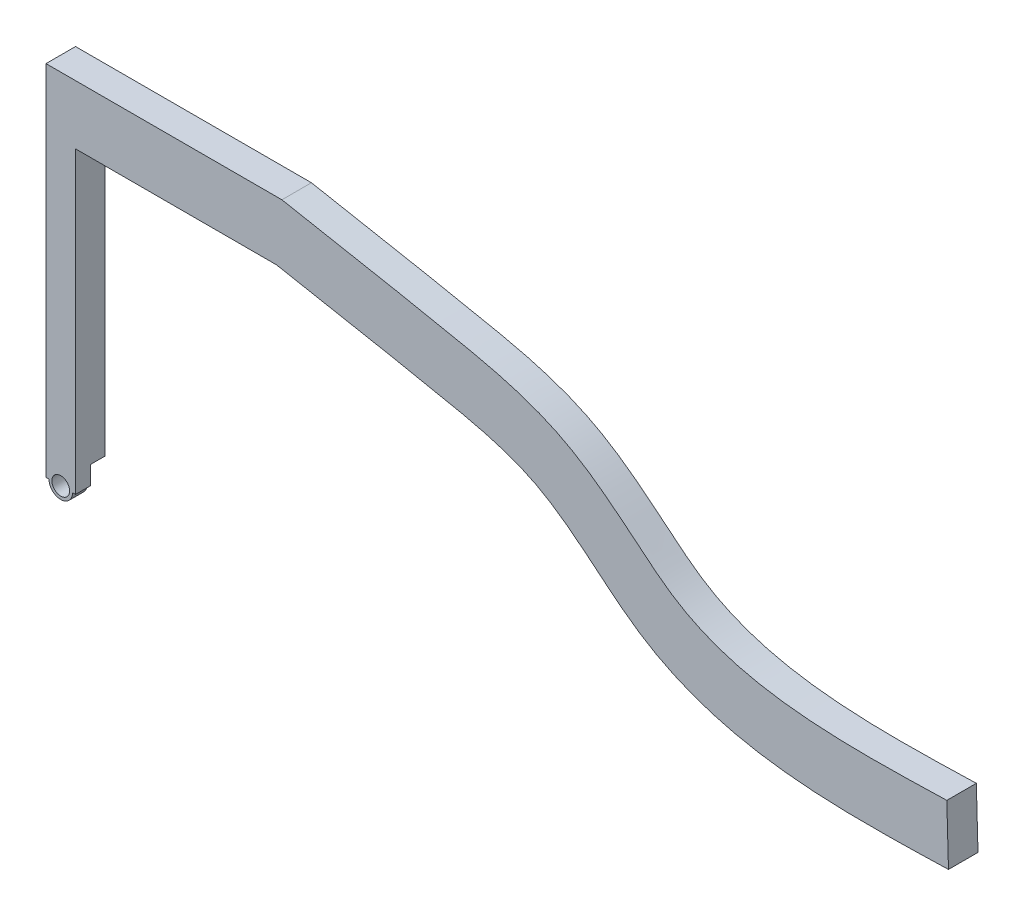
SolidWorks part; units mm, degrees
ref_plane "Front Plane" through (0, 0, 0) normal (0, 0, 1) x (1, 0, 0)
ref_plane "Top Plane" through (0, 0, 0) normal (0, 1, 0) x (1, 0, 0)
ref_plane "Right Plane" through (0, 0, 0) normal (1, 0, 0) x (0, 0, -1)
sketch "Sketch2" plane through (0, 0, 0) normal (0, 0, 1) x (1, 0, 0)
  line L0 (0, 0) -> (0, 13.3821)
  line L1 (0, 13.3821) -> (8.6425, 13.3821)
  spline S0 degree 3 poles (8.6425, 13.3821) (11.0062, 12.9415) (14.7474, 12.2441) (20.4161, 11.0334) (25.9492, 4.9848) (32.7321, 5.176) (37.5492, 5.3118) knots 0 0 0 0 0.238093 0.376845 0.55745 1 1 1 1
extrude "Extrude-Thin1" add sketch "Sketch2" along normal blind 1.27 thin
sketch "Sketch3" plane through (0, 0, 1.27) normal (0, 0, 1) x (1, 0, 0)
  line L0 (-1.27, 0) -> (-1.27, 15.9221)
  line L1 (0, 0) -> (-2.54, 0) construction
  line L2 (-2.54, 15.9221) -> (8.8772, 15.9221) construction
extrude "Extrude1" cut sketch "Sketch3" against normal through all and the other way through all
sketch "Sketch4" plane through (0, 0, 1.27) normal (0, 0, 1) x (1, 0, 0)
  circle A0 centre (-0.635, 0.508) radius 0.381
extrude "Extrude2" cut sketch "Sketch4" against normal through all
sketch "Sketch8" plane through (0, 0, 0) normal (1, 0, 0) x (0, 0, -1)
  line L0 (-0.635, 0) -> (-0.635, 1.016)
  line L1 (-1.27, 0) -> (0, 0) construction
  line L2 (-0.635, 1.016) -> (0, 1.016)
  line L4 (0, 0) -> (0, 13.3821) construction
extrude "Extrude6" cut sketch "Sketch8" against normal through all flip side to cut
sketch "Sketch12" plane through (0, 0, 0) normal (0, 0, -1) x (-1, 0, 0)
  circle A0 centre (0.635, 0.508) radius 1.016
extrude "Extrude10" cut sketch "Sketch12" against normal up to surface (0.635 mm away)
sketch "Sketch13" plane through (0, 0, 0.635) normal (0, 0, -1) x (-1, 0, 0)
  line L0 (0, 0) -> (1.27, 0) construction
  line L1 (0.127, 0.508) -> (0, 0.508)
  line L2 (0, 0) -> (0, 1.3011) construction
  line L3 (1.143, 0.508) -> (1.27, 0.508)
  line L4 (1.27, 0) -> (1.27, 1.3011) construction
  arc A0 (0.635, 0) -> (0.127, 0.508) centre (0.635, 0.508) cw
  arc A1 (0.635, 0) -> (1.143, 0.508) centre (0.635, 0.508) ccw
extrude "Extrude12" cut sketch "Sketch13" against normal through all and the other way through all flip side to cut
